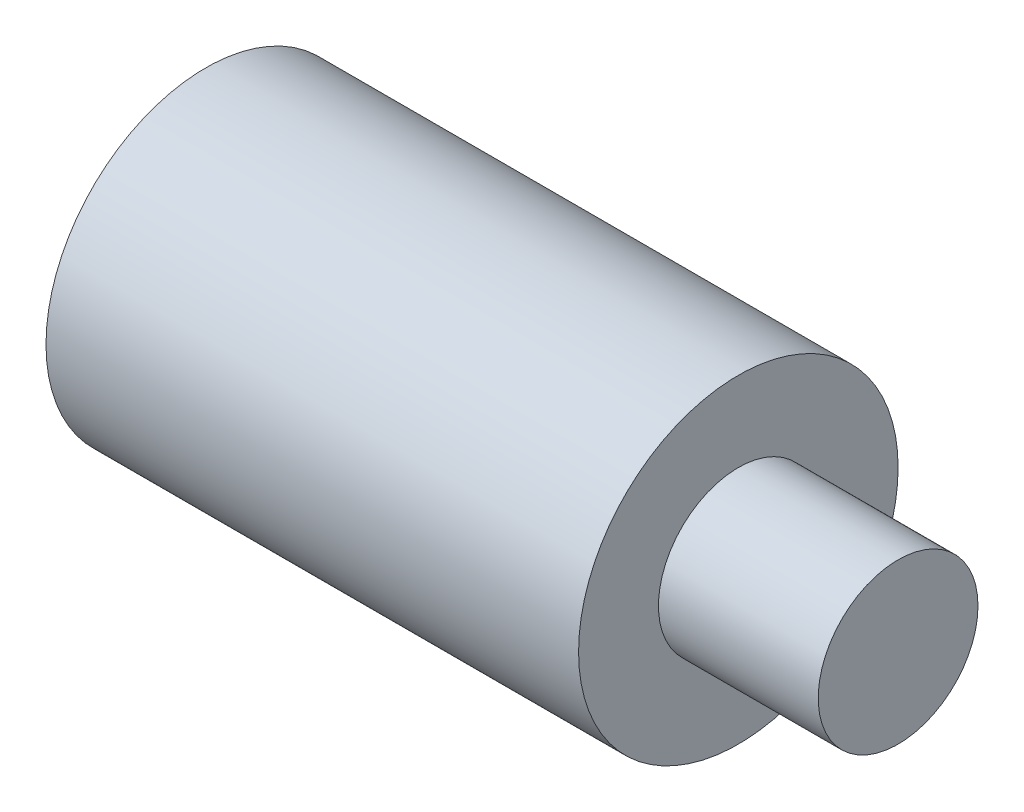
SolidWorks part; units mm, degrees
ref_plane "Front Plane" through (0, 0, 0) normal (0, 0, 1) x (1, 0, 0)
ref_plane "Top Plane" through (0, 0, 0) normal (0, 1, 0) x (1, 0, 0)
ref_plane "Right Plane" through (0, 0, 0) normal (1, 0, 0) x (0, 0, -1)
sketch "Sketch1" plane through (0, 0, 0) normal (1, 0, 0) x (0, 0, -1)
  circle A0 centre (0, 0) radius 30
  dimension "D1" = 60
extrude "Boss-Extrude1" add sketch "Sketch1" along normal mid plane 100
sketch "Sketch2" plane through (50, 0, 0) normal (1, 0, 0) x (0, 0, -1)
  circle A0 centre (0, 0) radius 15
  dimension "D1" = 30
extrude "Boss-Extrude2" add sketch "Sketch2" along normal blind 30
